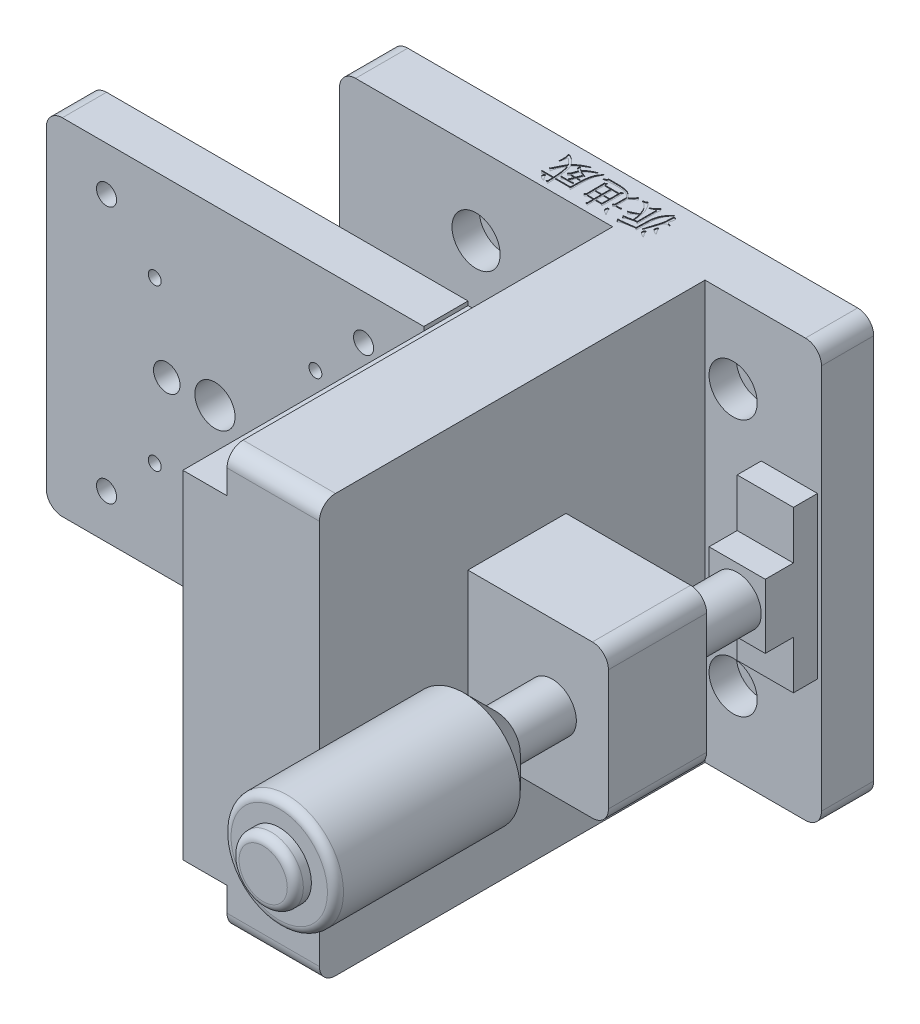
SolidWorks part; units mm, degrees
ref_plane "前视基准面" through (0, 0, 0) normal (0, 0, 1) x (1, 0, 0)
ref_plane "上视基准面" through (0, 0, 0) normal (0, 1, 0) x (1, 0, 0)
ref_plane "右视基准面" through (0, 0, 0) normal (1, 0, 0) x (0, 0, -1)
sketch "草图1" plane through (0, 0, 0) normal (0, 0, 1) x (1, 0, 0)
  line L1 (-30, 26) -> (30, 26)
  line L2 (-30, 26) -> (-30, -26)
  line L3 (-30, -26) -> (30, -26)
  line L4 (30, 26) -> (30, -26)
  line L5 (-30, 26) -> (30, -26) construction
  line L6 (-30, -26) -> (30, 26) construction
  point P0 (0, 0)
  dimension "D1" = 60
  dimension "D2" = 52
extrude "凸台-拉伸1" add sketch "草图1" along normal blind 6.5
sketch "草图2" plane through (0, 0, 6.5) normal (0, 0, 1) x (1, 0, 0)
  line L0 (30, -26) -> (30, 26) construction
  line L1 (15.5, 26) -> (4, 26)
  line L2 (15.5, 26) -> (15.5, -26)
  line L3 (15.5, -26) -> (4, -26)
  line L4 (4, 26) -> (4, -26)
  line L5 (30, 26) -> (-30, 26) construction
  line L6 (-30, -26) -> (30, -26) construction
  dimension "D1" = 14.5
  dimension "D2" = 11.5
extrude "凸台-拉伸2" add sketch "草图2" along normal blind 48
sketch "草图3" plane through (4, 0, 0) normal (-1, 0, 0) x (0, 0, 1)
  line L0 (0, 0) -> (48.141, 0) construction
  line L1 (54.5, 26) -> (54.5, -26) construction
  line L2 (54.5, 21) -> (19, 21)
  line L3 (54.5, 21) -> (54.5, -21)
  line L4 (54.5, -21) -> (19, -21)
  line L5 (19, 21) -> (19, -21)
  dimension "D1" = 42
  dimension "D2" = 21
  dimension "D3" = 35.5
extrude "凸台-拉伸3" add sketch "草图3" along normal blind 5.5
sketch "草图4" plane through (0, 0, 19) normal (0, 0, -1) x (-1, 0, 0)
  line L0 (1.5, -21) -> (1.5, 21) construction
  line L1 (1.5, 21.5) -> (48.5, 21.5)
  line L2 (1.5, 21.5) -> (1.5, -21.5)
  line L3 (1.5, -21.5) -> (48.5, -21.5)
  line L4 (48.5, 21.5) -> (48.5, -21.5)
  line L5 (0, 0) -> (-10.3123, 0) construction
  dimension "D1" = 43
  dimension "D2" = 47
extrude "凸台-拉伸4" add sketch "草图4" against normal blind 5.5
sketch "草图5" plane through (0, 0, 6.5) normal (0, 0, 1) x (1, 0, 0)
  line L0 (0, 0) -> (17.4945, 0) construction
  line L1 (29.5, 10) -> (22.5, 10)
  line L2 (29.5, 10) -> (29.5, -10)
  line L3 (29.5, -10) -> (22.5, -10)
  line L4 (22.5, 10) -> (22.5, -10)
  line L5 (30, -26) -> (30, 26) construction
  dimension "D1" = 0.5
  dimension "D2" = 20
  dimension "D3" = 10
  dimension "D4" = 7
extrude "凸台-拉伸5" add sketch "草图5" along normal blind 3
sketch "草图6" plane through (0, 0, 9.5) normal (0, 0, 1) x (1, 0, 0)
  line L0 (0, 0) -> (12.0542, 0) construction
  line L1 (29.5, 4) -> (22.5, 4)
  line L2 (29.5, 4) -> (29.5, -4)
  line L3 (29.5, -4) -> (22.5, -4)
  line L4 (22.5, 4) -> (22.5, -4)
  line L5 (22.5, 10) -> (22.5, -10) construction
  line L6 (29.5, -10) -> (29.5, 10) construction
  dimension "D1" = 8
extrude "凸台-拉伸6" add sketch "草图6" along normal blind 3.5
sketch "草图7" plane through (0, 0, 13) normal (0, 0, 1) x (1, 0, 0)
  circle A0 centre (26, 0) radius 3
  dimension "D1" = 6
extrude "凸台-拉伸7" add sketch "草图7" along normal blind 59
sketch "草图8" plane through (15.5, 0, 0) normal (1, 0, 0) x (0, 0, -1)
  line L0 (-6.5, -26) -> (-6.5, 26) construction
  line L1 (-23.8, 9.5) -> (-36.0186, 9.5)
  line L2 (-23.8, 9.5) -> (-23.8, -9.5)
  line L3 (-23.8, -9.5) -> (-36.0186, -9.5)
  line L4 (-36.0186, 9.5) -> (-36.0186, -9.5)
  line L5 (0, 0) -> (-18.9977, 0) construction
  dimension "D1" = 17.3
  dimension "D2" = 19
extrude "凸台-拉伸8" add sketch "草图8" along normal blind 17.5
fillet "圆角1" radius 2 2 edges at (33, 9.5, 29.9093) (33, -9.5, 29.9093)
fillet "圆角2" radius 2 8 edges at (-30, -26, 3.25) (-30, 26, 3.25) (-48.5, 21.5, 21.75) (-48.5, -21.5, 21.75) (9.75, 26, 54.5) (9.75, -26, 54.5) (30, 26, 3.25) (30, -26, 3.25)
sketch "草图9" plane through (0, 0, 72) normal (0, 0, 1) x (1, 0, 0)
  circle A0 centre (26, 0) radius 7
  dimension "D1" = 14
extrude "凸台-拉伸9" add sketch "草图9" against normal blind 30
chamfer "倒角1" distance 5 angle 45 1 edges at (33, 0, 42)
sketch "草图10" plane through (0, 0, 72) normal (0, 0, 1) x (1, 0, 0)
  circle A0 centre (26, 0) radius 4
  dimension "D1" = 8
extrude "切除-拉伸1" cut sketch "草图10" against normal blind 2 flip side to cut
fillet "圆角3" radius 1 2 edges at (30, 0, 72) (33, 0, 70)
hole_wizard "打孔尺寸(%根据)内六角圆柱头螺钉的类型0" positions "草图11" profile "草图12" counterbore size "M3" standard "GB"
sketch "草图11" plane through (0, 0, 6.5) normal (0, 0, 1) x (1, 0, 0)
  line L1 (30, -24) -> (30, 24) construction
  line L2 (0, 0) -> (10.5785, 0) construction
  point P0 (19, 16)
  point P2 (19, -16)
  point P4 (-13, 16)
  point P8 (-13, -16)
  dimension "D1" = 11
  dimension "D2" = 32
  dimension "D3" = 32
  dimension "D4" = 16
sketch "草图12" plane through (19, 16, 6.5) normal (1, 0, 0) x (0, -1, 0)
  line L0 (0, 0) -> (0, 6.5)
  line L1 (0, 6.5) -> (1.7, 6.5)
  line L3 (1.7, 6.5) -> (1.7, 3.4)
  line L4 (1.7, 3.4) -> (3, 3.4)
  line L5 (3, 3.4) -> (3, 0)
  line L7 (3, 0) -> (0, 0)
  line L11 (0, -6.35) -> (0, 107.95) construction
  dimension "通孔孔直径" = 3.4
  dimension "通孔孔深度" = 6.5
  dimension "柱形沉头孔直径" = 6
  dimension "柱形沉头孔深度" = 3.4
sketch "草图13" plane through (0, 0, 24.5) normal (0, 0, 1) x (1, 0, 0)
  line L0 (-25, 19.1427) -> (-25, -19.3941) construction
  line L1 (-1.5, -21) -> (-1.5, 21) construction
  line L2 (0, 0) -> (-54.0182, 0) construction
  dimension "D1" = 23.5
hole_wizard "M3 螺纹孔1" positions "草图14" profile "草图15" tap size "M3" standard "GB"
sketch "草图14" plane through (0, 0, 24.5) normal (0, 0, 1) x (1, 0, 0)
  line L0 (0, 0) -> (-54.0182, 0) construction
  line L1 (-25, 19.1427) -> (-25, -19.3941) construction
  point P0 (-41, 16)
  point P2 (-9, 16)
  point P4 (-41, -16)
  point P6 (-9, -16)
  point P9 (0, 0)
  point P10 (0, 0)
  point P11 (0, 0)
  point P12 (0, 0)
  dimension "D1" = 32
  dimension "D2" = 32
  dimension "D3" = 16
  dimension "D4" = 16
sketch "草图15" plane through (-41, 16, 24.5) normal (1, 0, 0) x (0, -1, 0)
  line L0 (0, 0) -> (0, 6.7511)
  line L1 (0, 6.7511) -> (1.25, 6)
  line L2 (1.25, 6) -> (1.25, 0)
  line L5 (1.25, 0) -> (0, 0)
  line L10 (0, 6.7511) -> (-1.25, 6) construction
  line L11 (0, -6.35) -> (0, 107.95) construction
  dimension "螺纹孔钻头直径" = 2.5
  dimension "螺纹孔钻头深度" = 6
  dimension "导头角度" = 118
hole_wizard "M2 螺纹孔1" positions "草图16" profile "草图17" tap size "M2" standard "GB"
sketch "草图16" plane through (0, 0, 24.5) normal (0, 0, 1) x (1, 0, 0)
  line L0 (0, 0) -> (-54.0182, 0) construction
  line L1 (-25, 19.1427) -> (-25, -19.3941) construction
  point P0 (-35, 10)
  point P2 (-15, 10)
  point P4 (-35, -10)
  point P6 (-15, -10)
  point P9 (0, 0)
  point P10 (0, 0)
  point P11 (0, 0)
  dimension "D1" = 20
  dimension "D2" = 20
  dimension "D3" = 10
  dimension "D4" = 10
sketch "草图17" plane through (-35, 10, 24.5) normal (1, 0, 0) x (0, -1, 0)
  line L0 (0, 0) -> (0, 8.4807)
  line L1 (0, 8.4807) -> (0.8, 8)
  line L2 (0.8, 8) -> (0.8, 0)
  line L5 (0.8, 0) -> (0, 0)
  line L10 (0, 8.4807) -> (-0.8, 8) construction
  line L11 (0, -6.35) -> (0, 107.95) construction
  dimension "螺纹孔钻头直径" = 1.6
  dimension "螺纹孔钻头深度" = 8
  dimension "导头角度" = 118
hole_wizard "M6 螺纹孔1" positions "草图18" profile "草图19" tap size "M6" standard "GB"
sketch "草图18" plane through (0, 0, 24.5) normal (0, 0, 1) x (1, 0, 0)
  line L0 (0, 0) -> (-54.0182, 0) construction
  line L1 (-1.5, 21) -> (-1.5, -21) construction
  point P0 (-27.5, 0)
  dimension "D1" = 26
sketch "草图19" plane through (-27.5, 0, 24.5) normal (1, 0, 0) x (0, -1, 0)
  line L0 (0, 0) -> (0, 16.5022)
  line L1 (0, 16.5022) -> (2.5, 15)
  line L2 (2.5, 15) -> (2.5, 0)
  line L5 (2.5, 0) -> (0, 0)
  line L10 (0, 16.5022) -> (-2.5, 15) construction
  line L11 (0, -6.35) -> (0, 107.95) construction
  dimension "螺纹孔钻头直径" = 5
  dimension "螺纹孔钻头深度" = 15
  dimension "导头角度" = 118
hole_wizard "M4 螺纹孔2" positions "草图20" profile "草图21" tap size "M4" standard "GB"
sketch "草图20" plane through (0, 0, 24.5) normal (0, 0, 1) x (1, 0, 0)
  line L0 (0, 0) -> (-54.0182, 0) construction
  line L1 (-1.5, -21) -> (-1.5, 21) construction
  point P0 (-33.5, 0)
  dimension "D1" = 32
sketch "草图21" plane through (-33.5, 0, 24.5) normal (1, 0, 0) x (0, -1, 0)
  line L0 (0, 0) -> (0, 11.0914)
  line L1 (0, 11.0914) -> (1.65, 10.1)
  line L2 (1.65, 10.1) -> (1.65, 0)
  line L5 (1.65, 0) -> (0, 0)
  line L10 (0, 11.0914) -> (-1.65, 10.1) construction
  line L11 (0, -6.35) -> (0, 107.95) construction
  dimension "螺纹孔钻头直径" = 3.3
  dimension "螺纹孔钻头深度" = 10.1
  dimension "导头角度" = 118
sketch "草图22" plane through (0, 26, 0) normal (0, 1, 0) x (1, 0, 0)
  line L0 (-15.5052, -1.8601) -> (16.4698, -1.8601) construction
  text T0 "派迪威"
extrude "切除-拉伸2" cut sketch "草图22" against normal blind 0.1
